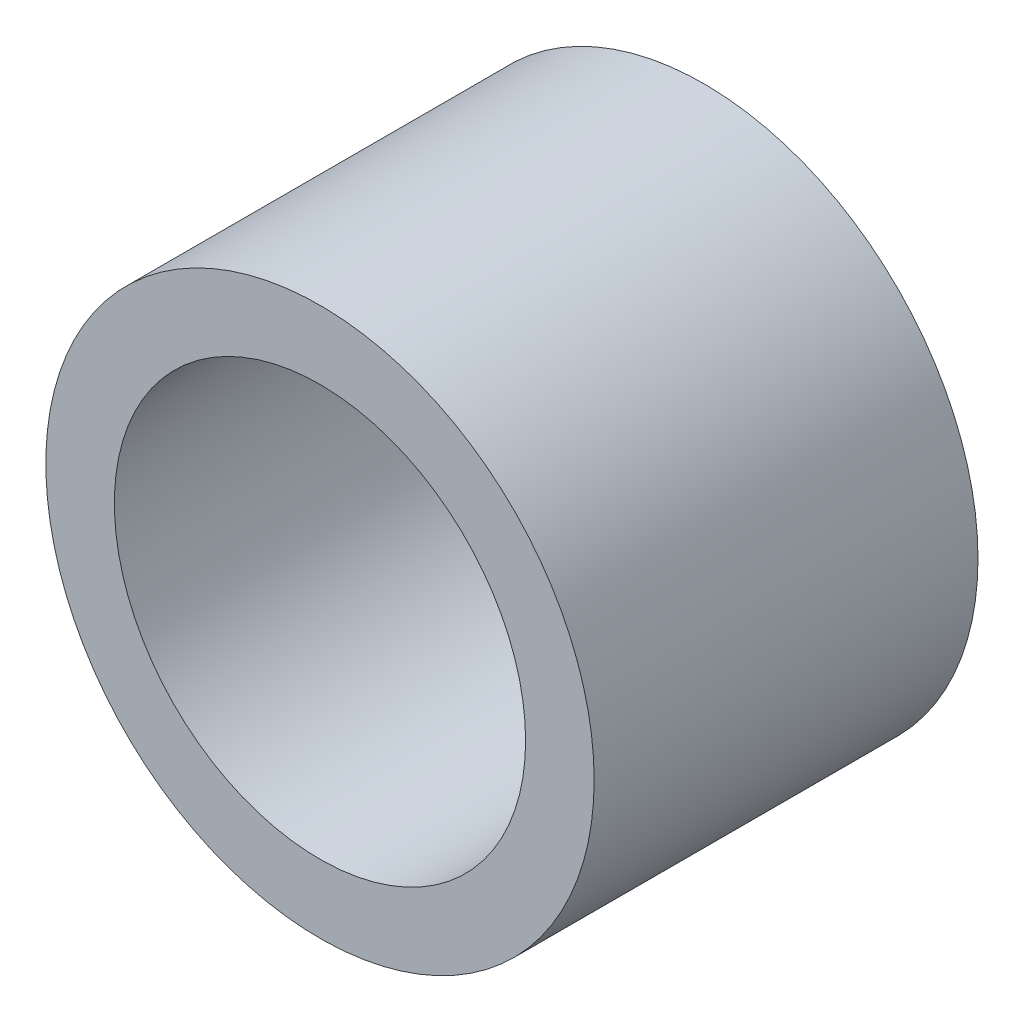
SolidWorks part; units mm, degrees
ref_plane "Front Plane" through (0, 0, 0) normal (0, 0, 1) x (1, 0, 0)
ref_plane "Top Plane" through (0, 0, 0) normal (0, 1, 0) x (1, 0, 0)
ref_plane "Right Plane" through (0, 0, 0) normal (1, 0, 0) x (0, 0, -1)
sketch "Sketch1" plane through (0, 0, 0) normal (0, 0, 1) x (1, 0, 0)
  circle A1 centre (-38.1, 0) radius 6.35
  circle A2 centre (-38.1, 0) radius 4.7625
  dimension "D1" = 12.7
  dimension "D2" = 9.525
extrude "Extrude1" add sketch "Sketch1" against normal blind 8.89
